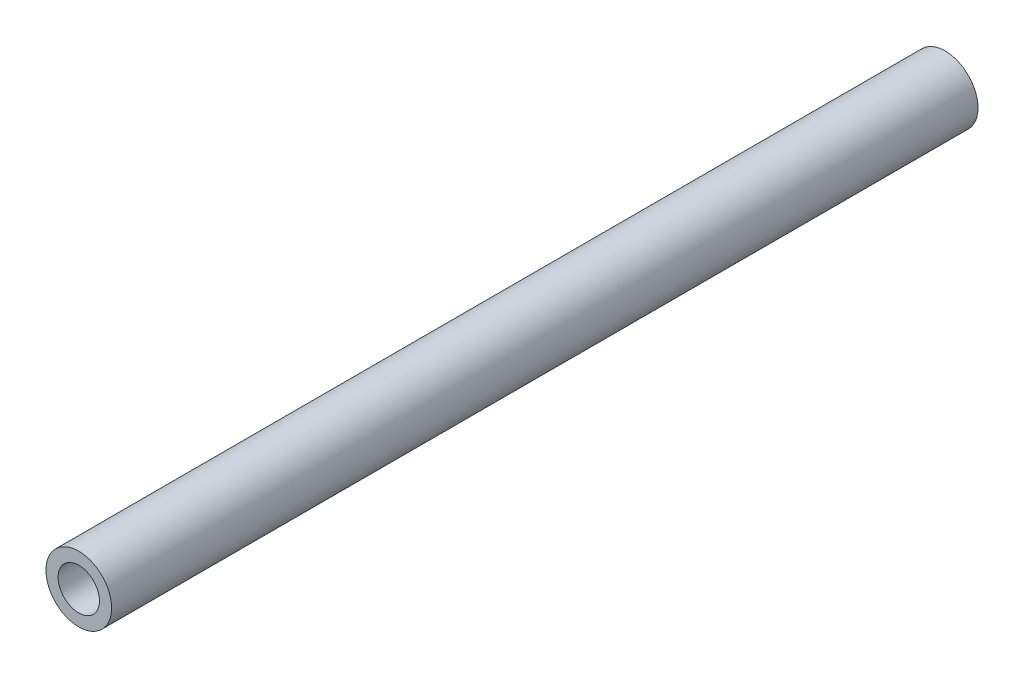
SolidWorks part; units mm, degrees
ref_plane "Front Plane" through (0, 0, 0) normal (0, 0, 1) x (1, 0, 0)
ref_plane "Top Plane" through (0, 0, 0) normal (0, 1, 0) x (1, 0, 0)
ref_plane "Right Plane" through (0, 0, 0) normal (1, 0, 0) x (0, 0, -1)
sketch "Sketch1" plane through (0, 0, 0) normal (0, 0, 1) x (1, 0, 0)
  circle A0 centre (97.5756, -340.2866) radius 2
  circle A1 centre (97.5756, -340.2866) radius 3.175
  dimension "D1" = 6.35
  dimension "D2" = 4
extrude "Extrude1" add sketch "Sketch1" along normal up to surface (83.7814 mm away)
